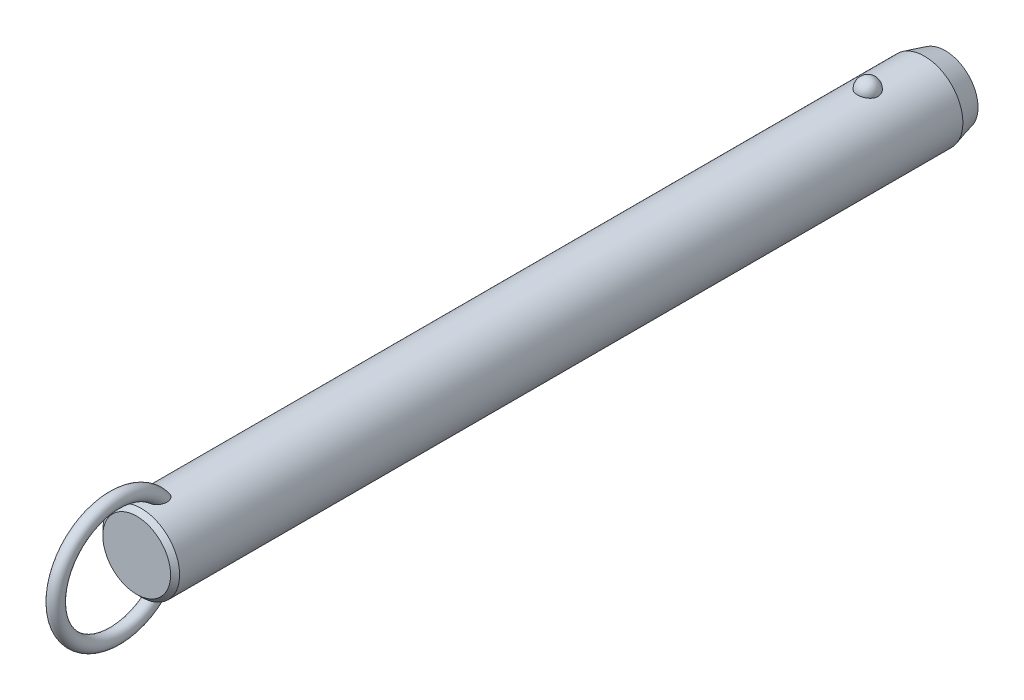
SolidWorks part; units mm, degrees
ref_plane "Front Plane" through (0, 0, 0) normal (0, 0, 1) x (1, 0, 0)
ref_plane "Top Plane" through (0, 0, 0) normal (0, 1, 0) x (1, 0, 0)
ref_plane "Right Plane" through (0, 0, 0) normal (1, 0, 0) x (0, 0, -1)
sketch "Sketch2" plane through (0, 0, 0) normal (0, 0, 1) x (1, 0, 0)
  circle A0 centre (0, 0) radius 11.1
  point P3 (0, 11.1)
  dimension "D1" = 22.2
extrude "Boss-Extrude1" add sketch "Sketch2" along normal blind 195.6
sketch "Sketch3" plane through (0, 0, 0) normal (0, 0, -1) x (-1, 0, 0)
  circle A0 centre (0, 0) radius 11.1
  dimension "D1" = 22.2
extrude "Boss-Extrude2" add sketch "Sketch3" along normal blind 25.4
chamfer "Chamfer1" distance 6 angle 15 1 edges at (-11.1, 0, -25.4)
sketch "Sketch12" plane through (0, 0, 0) normal (1, 0, 0) x (0, 0, -1)
  line L0 (-195.6, 11.1) -> (-195.6, -11.1) construction
  point P0 (-195.6, 0)
sketch "Sketch13" plane through (0, 0, 0) normal (1, 0, 0) x (0, 0, -1)
  circle A0 centre (-214.65, 0) radius 19.05
  point P2 (-195.6, 0)
  dimension "D1" = 38.1
sketch "Sketch14" plane through (0, 0, 0) normal (0, 1, 0) x (1, 0, 0)
  circle A0 centre (0, -197.6) radius 2
  point P2 (0, -195.6)
  dimension "D1" = 4
sweep "Sweep1" add profiles "Sketch14" path "Sketch13"
sketch "Sketch15" plane through (0, 0, 195.6) normal (0, 0, 1) x (1, 0, 0)
  circle A0 centre (0, 0) radius 11.1
  dimension "D1" = 22.2
extrude "Boss-Extrude3" add sketch "Sketch15" along normal blind 12.7
chamfer "Chamfer2" distance 1.3 angle 45 1 edges at (11.1, 0, 208.3)
sketch "Sketch18" plane through (0, 0, 0) normal (1, 0, 0) x (0, 0, -1)
  line L0 (19.4, 11.1) -> (-199.168, 11.1) construction
  line L1 (3, 14.1) -> (3, 8.1)
  line L2 (-199.168, -11.1) -> (19.4, -11.1) construction
  arc A0 (3, 14.1) -> (3, 8.1) centre (3, 11.1) ccw
  point P4 (0, 11.1)
  dimension "D1" = 25.2
revolve "Revolve1" add sketch "Sketch18" angle 360 about L1
